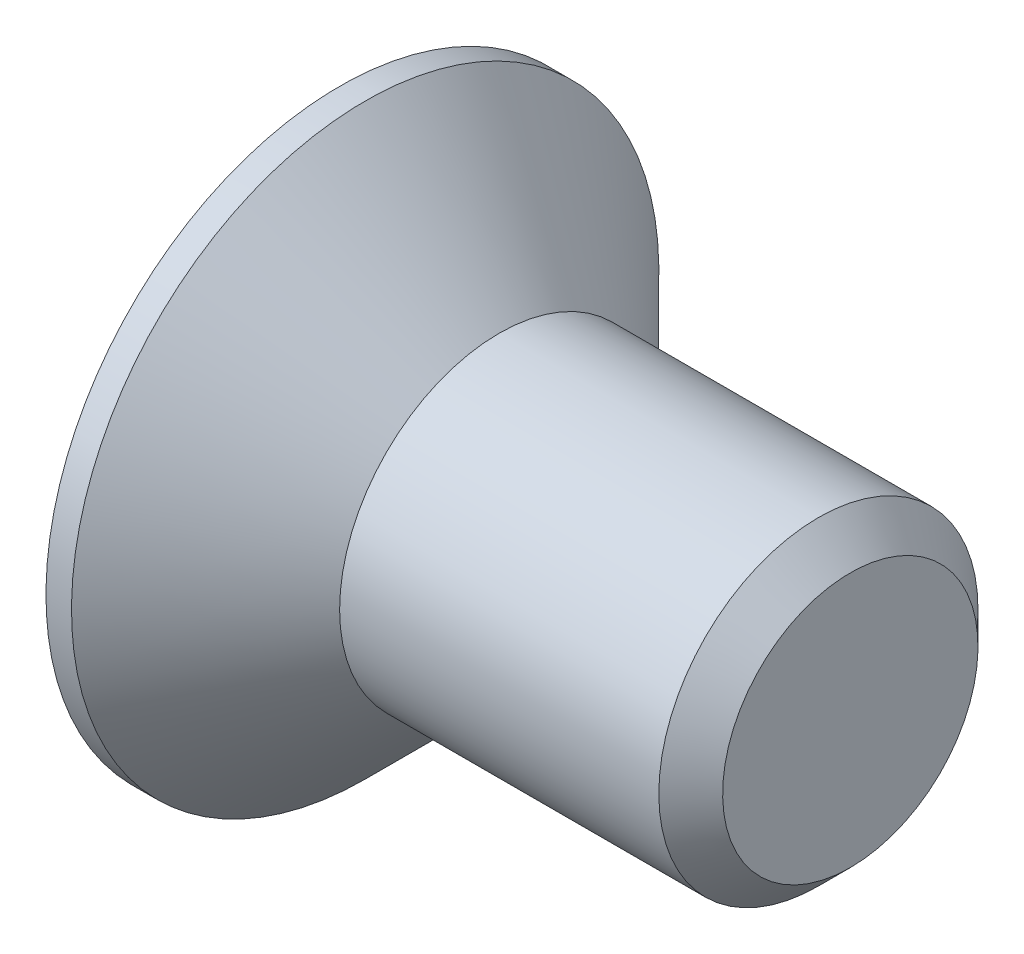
SolidWorks part; units mm, degrees
ref_plane "Front Plane" through (0, 0, 0) normal (0, 0, 1) x (1, 0, 0)
ref_plane "Top Plane" through (0, 0, 0) normal (0, 1, 0) x (1, 0, 0)
ref_plane "Right Plane" through (0, 0, 0) normal (1, 0, 0) x (0, 0, -1)
sketch "Sketch1" plane through (0, 0, 0) normal (0, 0, 1) x (1, 0, 0)
  line L1 (-2.5, 4.6) -> (-2.5, 0)
  line L2 (-2.5, 0) -> (5.5, 0)
  line L3 (5.5, 0) -> (5.5, 2.5)
  line L4 (5.5, 2.5) -> (0, 2.5)
  line L5 (-2.5, 4.6) -> (-2.1, 4.6)
  line L6 (-2.1, 4.6) -> (0, 2.5)
  dimension "D1" = 2.5
  dimension "D2" = 45
  dimension "D3" = 2.5
  dimension "D4" = 8
  dimension "D5" = 4.6
revolve "Revolve1" add sketch "Sketch1" angle 360 about L2
chamfer "Chamfer1" distance 0.5 angle 45 1 edges at (5.5, -2.5, 0)
sketch "Sketch2" plane through (-2.5, 0, 0) normal (-1, 0, 0) x (0, 0, 1)
  line L0 (-0.575, 2.3) -> (0.575, 2.3)
  line L1 (0.575, 2.3) -> (0.575, 0.575)
  line L2 (0.575, 0.575) -> (2.3, 0.575)
  line L3 (2.3, 0.575) -> (2.3, -0.575)
  line L4 (2.3, -0.575) -> (0.575, -0.575)
  line L5 (0.575, -0.575) -> (0.575, -2.3)
  line L6 (0.575, -2.3) -> (-0.575, -2.3)
  line L7 (-0.575, -2.3) -> (-0.575, -0.575)
  line L8 (-0.575, -0.575) -> (-2.3, -0.575)
  line L9 (-2.3, -0.575) -> (-2.3, 0.575)
  line L10 (-2.3, 0.575) -> (-0.575, 0.575)
  line L11 (-0.575, 0.575) -> (-0.575, 2.3)
  point P2 (0, 2.3)
  point P14 (0, -2.3)
  point P15 (2.3, 0)
  point P16 (-2.3, 0)
  dimension "D1" = 4.6
  dimension "D2" = 1.15
extrude "Cut-Extrude1" cut sketch "Sketch2" against normal blind 2.1
